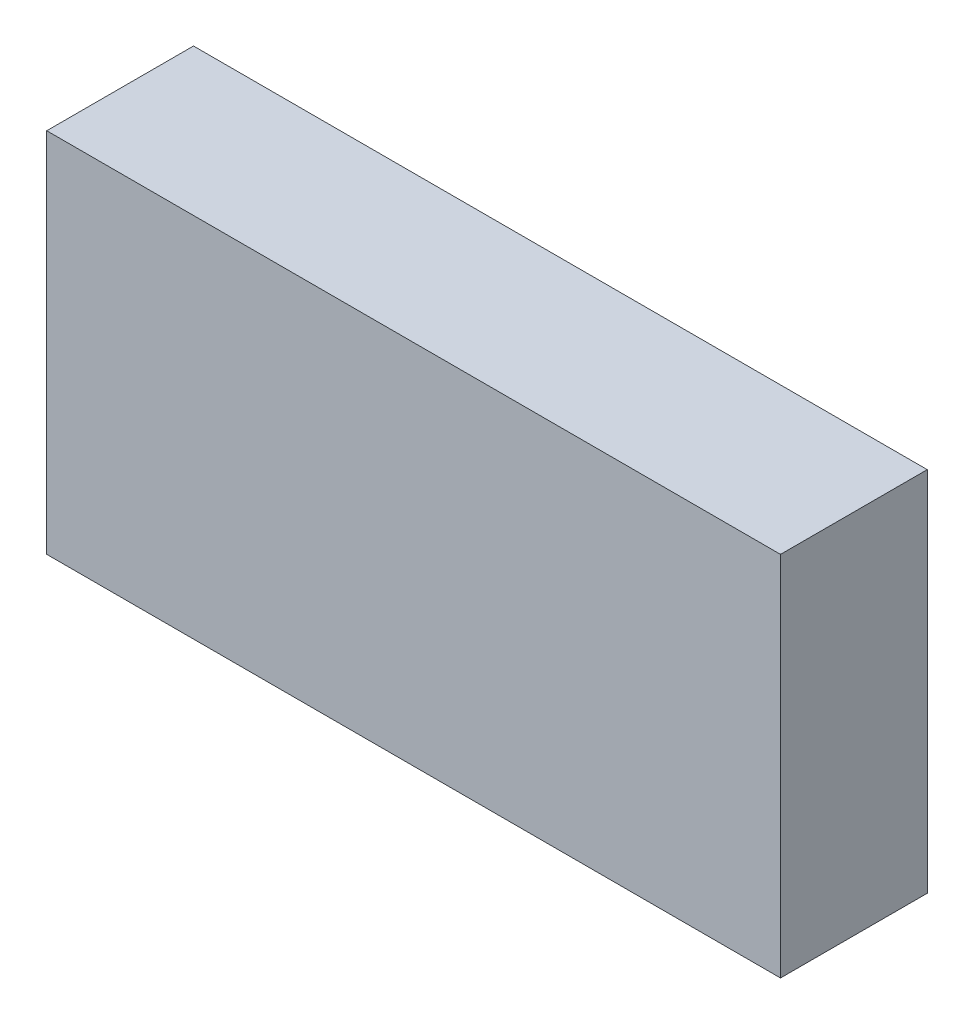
SolidWorks part; units mm, degrees
ref_plane "Ebene vorne" through (0, 0, 0) normal (0, 0, 1) x (1, 0, 0)
ref_plane "Ebene oben" through (0, 0, 0) normal (0, 1, 0) x (1, 0, 0)
ref_plane "Ebene rechts" through (0, 0, 0) normal (1, 0, 0) x (0, 0, -1)
sketch "Skizze1" plane through (0, 0, 0) normal (0, 0, 1) x (1, 0, 0)
  line L1 (0, 0) -> (50, 0)
  line L2 (0, 0) -> (0, 25)
  line L3 (0, 25) -> (50, 25)
  line L4 (50, 0) -> (50, 25)
  dimension "D1" = 50
  dimension "D2" = 25
extrude "Aufsatz-Linear austragen1" add sketch "Skizze1" along normal blind 10
